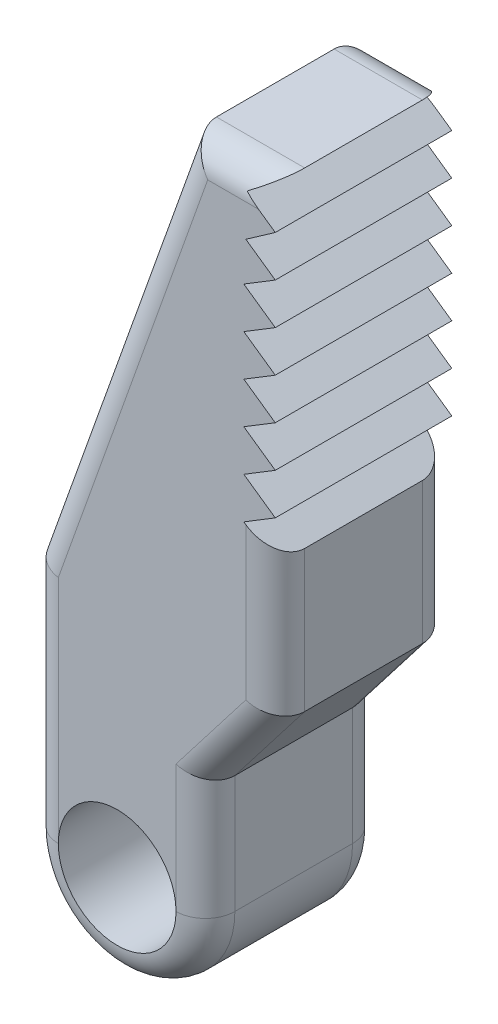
SolidWorks part; units mm, degrees
ref_plane "Plan de face" through (0, 0, 0) normal (0, 0, 1) x (1, 0, 0)
ref_plane "Plan de dessus" through (0, 0, 0) normal (0, 1, 0) x (1, 0, 0)
ref_plane "Plan de droite" through (0, 0, 0) normal (1, 0, 0) x (0, 0, -1)
sketch "Esquisse1" plane through (0, 0, 0) normal (0, 0, 1) x (1, 0, 0)
  line L0 (0, 0) -> (-15, 0) construction
  line L1 (0, 0) -> (20, 0) construction
  line L2 (15, 0) -> (15, 20)
  line L3 (-15, 0) -> (-15, 40)
  line L4 (-15, 40) -> (11.864, 115.3547)
  line L5 (11.864, 115.3547) -> (26.864, 115.3547)
  line L7 (26.864, 35.3547) -> (15, 20)
  line L8 (26.864, 115.3547) -> (21.864, 111.8547)
  line L9 (21.864, 111.8547) -> (26.864, 108.3547)
  line L10 (26.864, 108.3547) -> (21.864, 104.8547)
  line L11 (21.864, 104.8547) -> (26.864, 101.3547)
  line L12 (26.864, 101.3547) -> (26.864, 94.3547) construction
  line L13 (26.864, 94.3547) -> (26.864, 87.3547) construction
  line L14 (26.864, 87.3547) -> (26.864, 80.3547) construction
  line L15 (26.864, 80.3547) -> (26.864, 73.3547) construction
  line L16 (26.864, 73.3547) -> (26.864, 66.3547) construction
  line L17 (26.864, 66.3547) -> (26.864, 59.3547) construction
  line L18 (26.864, 101.3547) -> (21.5211, 98.0947)
  line L19 (21.5211, 98.0947) -> (26.864, 94.3547)
  line L20 (26.864, 94.3547) -> (21.5211, 91.0947)
  line L21 (21.5211, 91.0947) -> (26.864, 87.3547)
  line L22 (26.864, 87.3547) -> (21.5211, 84.0947)
  line L23 (21.5211, 84.0947) -> (26.864, 80.3547)
  line L24 (26.864, 80.3547) -> (21.5211, 77.0947)
  line L25 (21.5211, 77.0947) -> (26.864, 73.3547)
  line L26 (26.864, 73.3547) -> (21.5211, 70.0947)
  line L27 (21.5211, 70.0947) -> (26.864, 66.3547)
  line L28 (26.864, 66.3547) -> (21.5211, 63.0947)
  line L29 (21.5211, 63.0947) -> (26.864, 59.3547)
  line L30 (26.864, 59.3547) -> (26.864, 35.3547)
  circle A0 centre (0, 0) radius 10
  arc A2 (-15, 0) -> (15, 0) centre (0, 0) ccw
  dimension "D1" = 20
  dimension "D2" = 20
  dimension "D3" = 40
  dimension "D4" = 80
  dimension "D5" = 15
  dimension "D6" = 80
  dimension "D9" = 7
  dimension "D10" = 7
  dimension "D11" = 7
  dimension "D12" = 7
  dimension "D14" = 7
  dimension "D15" = 7
  dimension "D16" = 7
  dimension "D17" = 7
extrude "Boss.-Extru.1" add sketch "Esquisse1" along normal blind 30
fillet "Congé1" radius 5 14 edges at (26.864, 47.3547, 0) (26.864, 47.3547, 30) (20.932, 27.6773, 0) (20.932, 27.6773, 30) (15, 10, 0) (15, 10, 30) (0, -15, 0) (0, -15, 30) (-15, 20, 0) (-15, 20, 30) (-1.568, 77.6773, 0) (19.364, 115.3547, 0) (19.364, 115.3547, 30) (-1.568, 77.6773, 30)
